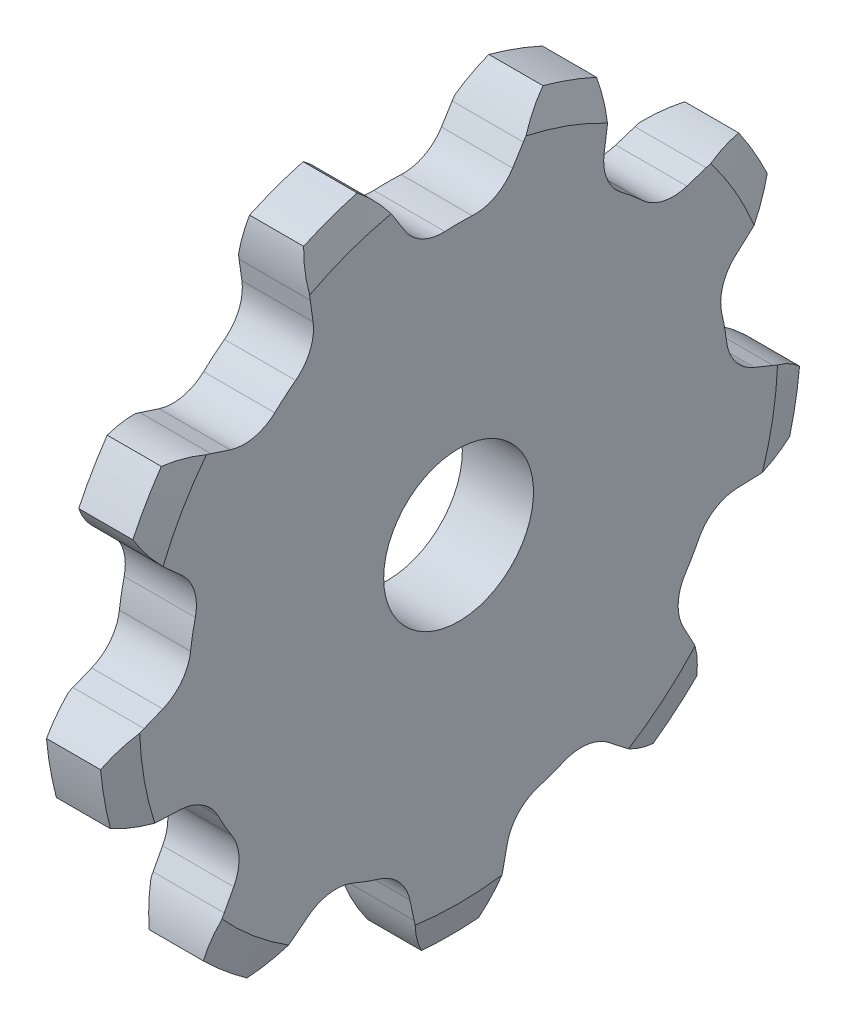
SolidWorks part; units mm, degrees
ref_plane "Plane1" through (0, 0, 0) normal (0, 0, 1) x (1, 0, 0)
ref_plane "Plane2" through (0, 0, 0) normal (0, 1, 0) x (1, 0, 0)
ref_plane "Plane3" through (0, 0, 0) normal (1, 0, 0) x (0, 0, -1)
sketch "Clipboard" plane through (0, 0, 0) normal (0, 1, 0) x (1, 0, 0)
  line L0 (0, 0) -> (75.2619, -11.9203)
  line L1 (-15, 0) -> (100, 0) construction
  line L2 (0, 0) -> (-2.1039, 2.3779)
  line L3 (0, 0) -> (-11.863, 4.5341)
  line L4 (0, 0) -> (8.5297, 1.351)
  line L5 (0, 0) -> (-71.3958, -26.6285)
  line L6 (0, 0) -> (-20.0029, -13.496)
  line L7 (-2.1039, 2.3779) -> (14.2981, 76.7917)
  line L8 (-76.2, 54.61) -> (-19.7358, 54.61)
  line L9 (-66.6514, 23.5599) -> (-48.0177, 27.5206)
  line L10 (-76.2, 71.12) -> (35.1969, 71.12)
  line L11 (0, 0) -> (-25.4, 0)
  line L12 (-76.2, 101.6) -> (-47.498, 101.6)
  circle A0 centre (0, 0) radius 19.05
  circle A1 centre (0, 0) radius 25.4
  circle A2 centre (0, 0) radius 25.4
  dimension "MHD" = 50.8
  dimension "Hub_dia" = 50.8
  dimension "Diameter" = 38.1
  dimension "Num_teeth" = 9
  dimension "Pitch_radius" = 111.3969
  dimension "Pitch" = 76.2
  dimension "Width" = 25.4
  dimension "Overall_len" = 76.2
  dimension "Show_teeth" = 9
  dimension "Thickness" = 24.13
  dimension "OAL" = 76.2001
  dimension "T_dim" = 56.4642
  dimension "Ap" = 12
  dimension "H" = 19.05
  dimension "F" = 28.702
sketch "BasProSke" plane through (0, 0, 0) normal (0, 1, 0) x (1, 0, 0)
  line L0 (-10, 0) -> (60, 0) construction
  line L1 (0, 0) -> (0, 108.2234)
  line L2 (0, 0) -> (24.13, 0)
  line L3 (24.13, 0) -> (24.13, 108.2234)
  line L4 (21.2344, 119.0299) -> (2.8956, 119.0299)
  line L5 (0, 108.2234) -> (2.8956, 119.0299)
  line L6 (24.13, 108.2234) -> (21.2344, 119.0299)
  dimension "D2" = 15
  dimension "D1" = 15
  dimension "G1" = 2.8956
  dimension "G2" = 2.8956
  dimension "Diameter" = 238.0598
  dimension "Thickness" = 24.13
revolve "Base-Revolve" add sketch "BasProSke" angle 360 about L0
sketch "TooCutSke" plane through (0, 0, 0) normal (1, 0, 0) x (0, 0, -1)
  line L0 (-18.3254, 98.6123) -> (-21.9596, 104.4283)
  line L1 (0, 0) -> (0, 107) construction
  line L2 (3.81, 0) -> (3.81, 141.3423) construction
  line L3 (18.3254, 98.6123) -> (21.9596, 104.4283)
  line L4 (44.0158, 120.9324) -> (48.3595, 132.8665)
  line L5 (3.81, 115.7694) -> (59.0408, 81.2573) construction
  line L6 (-44.0158, 120.9324) -> (-48.3595, 132.8665)
  arc A0 (4.6306, 91.4678) -> (-4.6306, 91.4678) centre (0, 0) ccw
  arc A1 (4.6306, 91.4678) -> (18.3254, 98.6123) centre (5.4011, 106.6883) ccw
  arc A2 (-4.6306, 91.4678) -> (-18.3254, 98.6123) centre (-5.4011, 106.6883) cw
  circle A3 centre (0, 0) radius 111.3969 construction
  circle A4 centre (3.81, 111.3318) radius 19.05 construction
  arc A5 (21.9596, 104.4283) -> (44.0158, 120.9324) centre (54.2702, 84.2383) cw
  arc A6 (-21.9596, 104.4283) -> (-44.0158, 120.9324) centre (-54.2702, 84.2383) ccw
  arc A7 (48.3595, 132.8665) -> (-48.3595, 132.8665) centre (0, 0) ccw
  dimension "D1" = 12.7
  dimension "R" = 15.24
  dimension "Db" = 91.5849
  dimension "H" = 19.05
  dimension "Pitch_radius" = 111.3969
  dimension "Rt" = 38.1
  dimension "Ag" = 64
  dimension "Cp" = 3.81
  dimension "Wf" = 6.858
  dimension "Angle" = 40
extrude "ToothCut" cut sketch "TooCutSke" along normal through all
pattern_circular "TeethCuts" count 9 every 40 about axis through (-10, 0, 0) along (1, 0, 0) of "ToothCut"
sketch "HubNeaOneSke" plane through (0, 0, 0) normal (-1, 0, 0) x (0, 0, 1)
  circle A0 centre (0, 0) radius 25.4
  dimension "Diameter" = 50.8
extrude "HubNearOne" [suppressed] add sketch "HubNeaOneSke" along normal blind 52.0701
sketch "HubNeaBotSke" plane through (0, 0, 0) normal (-1, 0, 0) x (0, 0, 1)
  circle A0 centre (0, 0) radius 25.4
  dimension "Diameter" = 50.8
extrude "HubNearBoth" [suppressed] add sketch "HubNeaBotSke" along normal blind 26.035
ref_plane "FarPln" through (24.13, 0, 0) normal (1, 0, 0) x (0, 0, -1)
sketch "HubFarSke" plane through (24.13, 0, 0) normal (1, 0, 0) x (0, 0, -1)
  circle A0 centre (0, 0) radius 25.4
  dimension "Diameter" = 50.8
extrude "HubFar" [suppressed] add sketch "HubFarSke" along normal blind 26.035
sketch "BorSke" plane through (0, 0, 0) normal (1, 0, 0) x (0, 0, -1)
  circle A0 centre (0, 0) radius 25.4
  dimension "Diameter" = 50.8
extrude "Bore" cut sketch "BorSke" along normal mid plane 152.4001
sketch "KeySke" plane through (0, 0, 0) normal (1, 0, 0) x (0, 0, -1)
  line L0 (-6.35, 0) -> (-6.35, 31.0642)
  line L1 (-6.35, 31.0642) -> (6.35, 31.0642)
  line L2 (6.35, 31.0642) -> (6.35, 0)
  line L3 (0, 0) -> (0, 34) construction
  line L4 (-6.35, 0) -> (6.35, 0)
  dimension "Offset" = 31.0642
  dimension "Width" = 12.7
extrude "Keyway" [suppressed] cut sketch "KeySke" along normal mid plane 152.4001
pattern_circular "Keyway2" [suppressed] count 2 every 90 about axis through (-10, 0, 0) along (1, 0, 0)
equation "\"Thickness@Clipboard\" = \"Width@Clipboard\" * 0.95"
equation "\"H@Clipboard\" = \"Diameter@Clipboard\" / 2.0"
equation "\"OAL@Clipboard\" = \"Thickness@Clipboard\""
equation "\"Pitch_radius@Clipboard\" = ( \"Pitch@Clipboard\" / 2.0) / sin(3.14159265 / \"Num_teeth@Clipboard\" )"
equation "\"MHD@Clipboard\" = (1.0 / tan(3.14159265 / \"Num_teeth@Clipboard\" ) - 0.05) * \"Pitch@Clipboard\" - \"F@Clipboard\""
equation "\"MHD@Clipboard\" = ((sgn( \"MHD@Clipboard\" - \"Hub_dia@Clipboard\" )-1)*( \"MHD@Clipboard\" - \"Hub_dia@Clipboard\" ))/-2+ \"Hub_dia@Clipboard\""
equation "\"OAL@Clipboard\" = ((sgn( \"OAL@Clipboard\" - \"Overall_len@Clipboard\" )+1)*( \"OAL@Clipboard\" - \"Overall_len@Clipboard\" ))/2 + \"Overall_len@Clipboard\" + 0.000002"
equation "\"Num_teeth@TeethCuts\" = int( \"Show_teeth@Clipboard\" ) + 1"
equation "\"Num_teeth@TeethCuts\" = ((sgn( \"Num_teeth@TeethCuts\" - \"Num_teeth@Clipboard\" )-1)*( \"Num_teeth@TeethCuts\" - \"Num_teeth@Clipboard\" ))/-2+ \"Num_teeth@Clipboard\""
equation "\"Num_teeth@TeethCuts\" = ((sgn( \"Num_teeth@TeethCuts\" - 2.0)+1)*( \"Num_teeth@TeethCuts\" - 2.0))/2 +2.0"
equation "\"Angle@TeethCuts\" = 360.0 / \"Num_teeth@Clipboard\""
equation "\"Pitch_radius@TooCutSke\" = \"Pitch_radius@Clipboard\""
equation "\"Cp@TooCutSke\" = 0.05 * \"Pitch@Clipboard\""
equation "\"Rt@TooCutSke\" = 0.5 * \"Pitch@Clipboard\""
equation "\"R@TooCutSke\"  = 0.8 * \"H@Clipboard\""
equation "\"Db@TooCutSke\" = \"Pitch_radius@Clipboard\" - \"H@Clipboard\" - 0.03"
equation "\"Ag@TooCutSke\" =  2.0 * \"Ap@Clipboard\" + 360.0 / \"Num_teeth@Clipboard\""
equation "\"H@TooCutSke\" = \"H@Clipboard\""
equation "\"Angle@TooCutSke\" =  360.0 / \"Num_teeth@Clipboard\""
equation "\"Wf@TooCutSke\" = 0.01 * \"Pitch@Clipboard\" * \"Num_teeth@Clipboard\""
equation "\"Wf@TooCutSke\" = ((sgn( \"Wf@TooCutSke\" - \"H@Clipboard\" * 0.8 )-1)*( \"Wf@TooCutSke\" - \"H@Clipboard\" * 0.8 ))/-2+ \"H@Clipboard\" * 0.8"
equation "\"Diameter@BasProSke\" = (1.0 / tan(3.14159265 / \"Num_teeth@Clipboard\" )) * \"Pitch@Clipboard\" + \"F@Clipboard\""
equation "\"Thickness@BasProSke\"  = \"Thickness@Clipboard\""
equation "\"G1@BasProSke\" =  \"Thickness@Clipboard\" * 0.12"
equation "\"G2@BasProSke\" =   \"Thickness@Clipboard\" * 0.12"
equation "\"MHD@Clipboard\" = ((sgn( \"MHD@Clipboard\" - \"Db@TooCutSke\" * 2.0  )-1)*( \"MHD@Clipboard\" - \"Db@TooCutSke\" * 2.0 ))/-2+ \"Db@TooCutSke\" * 2.0"
equation "\"Diameter@HubNeaOneSke\" = \"MHD@Clipboard\""
equation "\"Length@HubNearOne\" = \"OAL@Clipboard\" - \"Thickness@BasProSke\""
equation "\"Diameter@HubNeaBotSke\" = \"MHD@Clipboard\""
equation "\"Length@HubNearBoth\" = ( \"OAL@Clipboard\" - \"Thickness@BasProSke\" ) / 2.0"
equation "\"Thickness@FarPln\" = \"Thickness@BasProSke\""
equation "\"Diameter@HubFarSke\" = \"MHD@Clipboard\""
equation "\"Length@HubFar\" = ( \"OAL@Clipboard\" - \"Thickness@BasProSke\" ) / 2.0"
equation "\"D1@Bore\" = \"OAL@Clipboard\" * 2.0"
equation "\"D1@Keyway\" = \"OAL@Clipboard\" * 2.0"
equation "\"Offset@KeySke\" = \"T_dim@Clipboard\" - \"Diameter@BorSke\" / 2.0"
